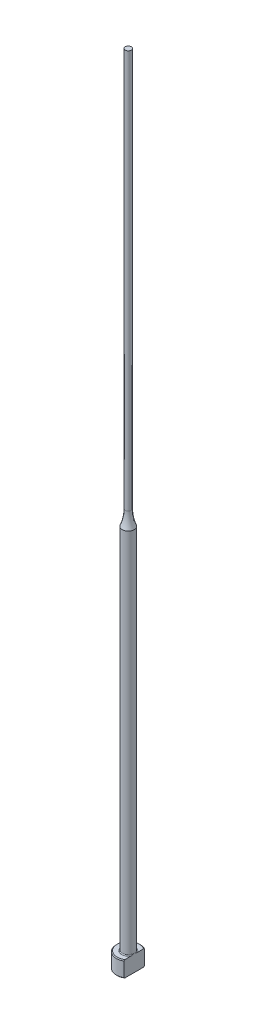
SolidWorks part; units mm, degrees
ref_plane "Front Plane" through (0, 0, 0) normal (0, 0, 1) x (1, 0, 0)
ref_plane "Top Plane" through (0, 0, 0) normal (0, 1, 0) x (1, 0, 0)
ref_plane "Right Plane" through (0, 0, 0) normal (1, 0, 0) x (0, 0, -1)
sketch "Sketch1" plane through (0, 0, 0) normal (0, 0, 1) x (1, 0, 0)
  line L0 (0, 259.9588) -> (0, -15.1925) construction
  line L1 (0, 0) -> (-3, 0)
  line L2 (-3, 0) -> (-3, 4)
  line L3 (-3, 4) -> (-1.5, 4)
  line L4 (-0.75, 100) -> (-0.75, 200)
  line L5 (-0.75, 200) -> (0, 200)
  line L6 (0, 200) -> (0, 0)
  line L7 (-1.5, 4) -> (-1.5, 96.2003)
  arc A0 (-1.5, 96.2003) -> (-0.75, 100) centre (-10.75, 100) ccw
  point P13 (-1.5, 0)
  dimension "D1" = 10
  dimension "L" = 200
  dimension "H" = 6
  dimension "T" = 4
  dimension "D" = 1.5
  dimension "B" = 3
  dimension "S" = 100
revolve "Revolve1" add sketch "Sketch1" angle 360 about L0
chamfer "Chamfer1" distance 0.2 angle 45 2 edges at (0, 4, 3) (0, 0, 3)
fillet "Fillet1" radius 0.2 1 edges at (0, 4, 1.5)
sketch "Sketch2" plane through (0, 0, 0) normal (0, 1, 0) x (1, 0, 0)
  line L0 (1.5, -2.5981) -> (1.5, 2.5981)
  circle A0 centre (0, 0) radius 3 construction
  arc A1 (1.5, -2.5981) -> (1.5, 2.5981) centre (0, 0) ccw
  circle A2 centre (0, 0) radius 1.5 construction
extrude "Keyed Head" cut sketch "Sketch2" along normal through all
